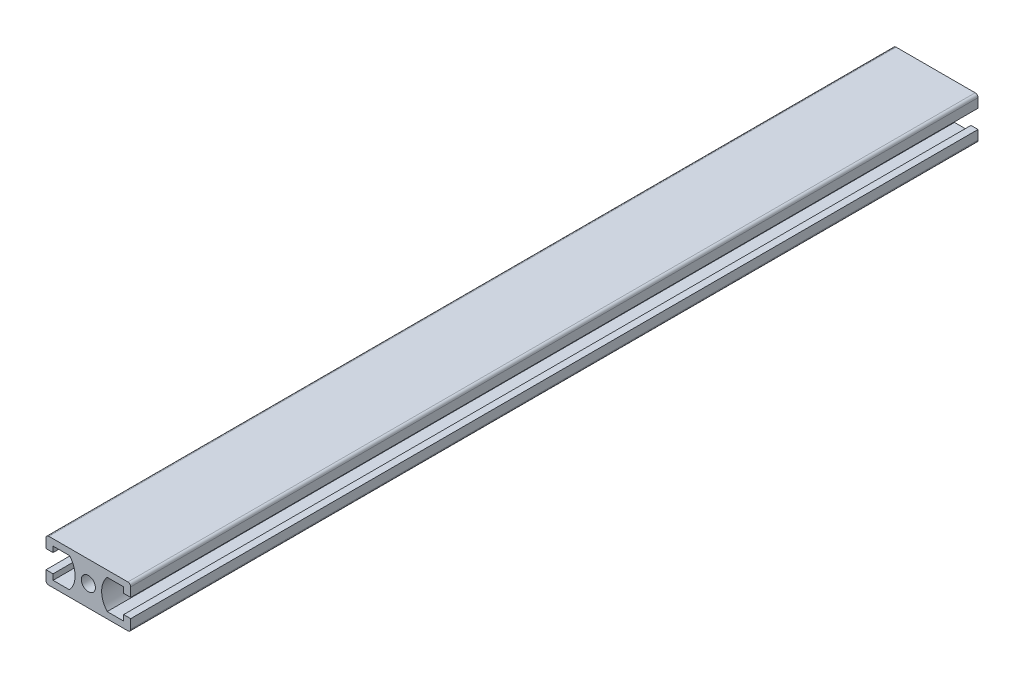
SolidWorks part; units mm, degrees
ref_plane "前视基准面" through (0, 0, 0) normal (0, 0, 1) x (1, 0, 0)
ref_plane "上视基准面" through (0, 0, 0) normal (0, 1, 0) x (1, 0, 0)
ref_plane "右视基准面" through (0, 0, 0) normal (1, 0, 0) x (0, 0, -1)
sketch "草图1" plane through (0, 0, 0) normal (0, 0, 1) x (1, 0, 0)
  line B0 (-6.6637, -5.25) -> (-12.5, -5.25)
  line B1 (-12.5, -5.25) -> (-12.5, -3.25)
  line B2 (-12.5, -3.25) -> (-15, -3.25)
  line B3 (-15, -3.25) -> (-15, -6.5)
  line B4 (-14, -7.5) -> (14, -7.5)
  line B5 (15, -6.5) -> (15, -3.25)
  line B6 (15, -3.25) -> (12.5, -3.25)
  line B7 (12.5, -3.25) -> (12.5, -5.25)
  line B8 (12.5, -5.25) -> (6.6637, -5.25)
  line B9 (6.6637, 5.25) -> (12.5, 5.25)
  line B10 (12.5, 5.25) -> (12.5, 3.25)
  line B11 (12.5, 3.25) -> (15, 3.25)
  line B12 (15, 3.25) -> (15, 6.5)
  line B13 (14, 7.5) -> (-14, 7.5)
  line B14 (-15, 6.5) -> (-15, 3.25)
  line B15 (-15, 3.25) -> (-12.5, 3.25)
  line B16 (-12.5, 3.25) -> (-12.5, 5.25)
  line B17 (-12.5, 5.25) -> (-6.6637, 5.25)
  arc B18 (-6.6637, -5.25) -> (-6.6637, 5.25) centre (-12.7, 0) ccw
  arc B19 (-15, -6.5) -> (-14, -7.5) centre (-14, -6.5) ccw
  arc B20 (14, -7.5) -> (15, -6.5) centre (14, -6.5) ccw
  arc B21 (6.6637, 5.25) -> (6.6637, -5.25) centre (12.7, 0) ccw
  arc B22 (15, 6.5) -> (14, 7.5) centre (14, 6.5) ccw
  arc B23 (-14, 7.5) -> (-15, 6.5) centre (-14, 6.5) ccw
  circle B24 centre (0, 0) radius 2.5
sketch_block_instance "A$C60236D11-1"
sketch_block "A$C60236D11"
extrude "凸台-拉伸1" add sketch "草图1" along normal mid plane 300
